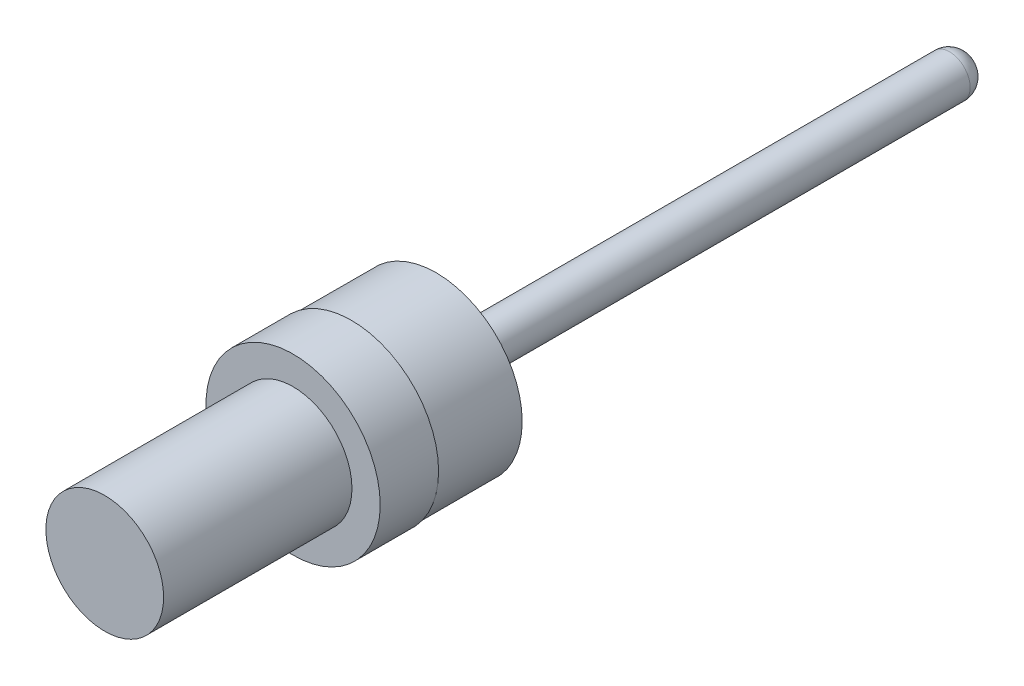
SolidWorks part; units mm, degrees
ref_plane "Plane1" through (0, 0, 0) normal (0, 0, 1) x (1, 0, 0)
ref_plane "Plane2" through (0, 0, 0) normal (0, 1, 0) x (1, 0, 0)
ref_plane "Plane3" through (0, 0, 0) normal (1, 0, 0) x (0, 0, -1)
sketch "Sketch1" plane through (0, 0, 0) normal (0, 0, 1) x (1, 0, 0)
  circle A0 centre (0, 0) radius 4.699
  dimension "D1" = 9.398
extrude "Base-Extrude" add sketch "Sketch1" along normal blind 3.1496
sketch "Sketch2" plane through (0, 0, 0) normal (0, 0, -1) x (-1, 0, 0)
  circle A0 centre (0, 0) radius 4.6355
  dimension "D1" = 9.271
extrude "rubber" add sketch "Sketch2" along normal blind 4.572
sketch "Sketch3" plane through (0, 0, -4.572) normal (0, 0, -1) x (-1, 0, 0)
  circle A0 centre (0, 0) radius 1.1176
  dimension "D1" = 2.2352
extrude "Boss-Extrude2" add sketch "Sketch3" along normal blind 28.702
fillet "Fillet1" radius 1.016 1 edges at (-1.1176, 0, -33.274)
sketch "Sketch4" plane through (0, 0, 3.1496) normal (0, 0, 1) x (1, 0, 0)
  circle A0 centre (0, 0) radius 3.175
  dimension "D1" = 6.35
extrude "Boss-Extrude3" add sketch "Sketch4" along normal blind 10.16
